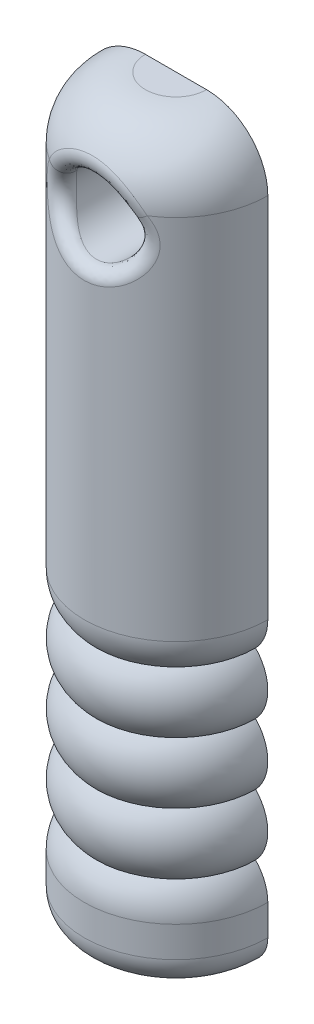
SolidWorks part; units mm, degrees
ref_plane "Front" through (0, 0, 0) normal (0, 0, 1) x (1, 0, 0)
ref_plane "Top" through (0, 0, 0) normal (0, 1, 0) x (1, 0, 0)
ref_plane "Right" through (0, 0, 0) normal (1, 0, 0) x (0, 0, -1)
sketch "Esquisse2" plane through (0, 0, 0) normal (0, 1, 0) x (1, 0, 0)
  circle A0 centre (0, 0) radius 15
  dimension "D1" = 30
extrude "Boss.-Extru.1" add sketch "Esquisse2" along normal blind 120
fillet "Congé1" radius 10 1 edges at (0, 120, 15)
fillet "Congé2" radius 5 1 edges at (0, 0, 15)
sketch "Esquisse3" plane through (0, 0, 0) normal (0, 0, 1) x (1, 0, 0)
  line L0 (-15, 20) -> (-15, 10)
  line L1 (-15, 110) -> (-15, 5) construction
  line L2 (-15, 15) -> (-13, 15)
  line L3 (-10, 0) -> (10, 0) construction
  line L4 (0, 0) -> (0, 19.1944) construction
  arc A0 (-15, 10) -> (-13, 15) centre (-7.75, 10) cw
  arc A1 (-15, 20) -> (-13, 15) centre (-7.75, 20) ccw
  dimension "D2" = 7.25
  dimension "D1" = 10
  dimension "D3" = 5
revolve "Enlèvement de matière-Révolution1" cut sketch "Esquisse3" angle 360 about L4
pattern_linear "Répétition linéaire1" count 4 spacing 10 along (0, 1, 0) of "Enlèvement de matière-Révolution1"
sketch "Esquisse4" plane through (0, 0, 0) normal (0, 0, 1) x (1, 0, 0)
  line L0 (5, 120) -> (-5, 120) construction
  circle A0 centre (0, 106) radius 6
  dimension "D2" = 12
  dimension "D1" = 14
extrude "Enlèv. mat.-Extru.1" cut sketch "Esquisse4" against normal mid plane 120
fillet "Congé3" radius 2 4 edges at (0.0283, 100.0001, -15) (-0.0283, 100.0001, 15) (1.0837, 111.9013, 14.7779) (-1.0837, 111.9013, -14.7779)
sketch "Esquisse5" plane through (0, 0, 0) normal (0, -1, 0) x (1, 0, 0)
  line L1 (-5, 1.6) -> (5, 1.6)
  line L2 (-5, 1.6) -> (-5, -1.6)
  line L3 (-5, -1.6) -> (5, -1.6)
  line L4 (5, 1.6) -> (5, -1.6)
  line L5 (-5, 1.6) -> (5, -1.6) construction
  line L6 (-5, -1.6) -> (5, 1.6) construction
  point P0 (0, 0)
  dimension "D1" = 3.2
  dimension "D2" = 10
sketch "Esquisse6" plane through (0, 0, 0) normal (0, 0, 1) x (1, 0, 0)
  line L1 (-43.8641, 151.4993) -> (49.8238, 151.4993)
  line L2 (-43.8641, 151.4993) -> (-43.8641, -51.0701)
  line L3 (-43.8641, -51.0701) -> (49.8238, -51.0701)
  line L4 (49.8238, 151.4993) -> (49.8238, -51.0701)
extrude "Enlèv. mat.-Extru.3" cut sketch "Esquisse6" against normal blind 40
shell "Coque2" thickness 2
fillet "Congé4" radius 2 4 edges at (0, 45, 9.3508) (0, 25, 9.3508) (0, 15, 9.3508) (0, 35, 9.3508)
sketch "Esquisse7" plane through (0, 0, 0) normal (0, 0, -1) x (-1, 0, 0)
  line L1 (-6.5, 0) -> (6.5, 0)
  line L2 (-6.5, 0) -> (-6.5, 42)
  line L3 (-6.5, 42) -> (6.5, 42)
  line L4 (6.5, 0) -> (6.5, 42)
  line L5 (10, 0) -> (-10, 0) construction
  line L6 (5, 0) -> (-5, 0) construction
  line L8 (-5, 40.5) -> (5, 40.5)
  line L9 (5, 1.5) -> (5, 40.5)
  line L10 (-5, 1.5) -> (5, 1.5)
  line L11 (-5, 1.5) -> (-5, 40.5)
  dimension "D1" = 42
  dimension "D2" = 13
  dimension "D3" = 1.5
extrude "Boss.-Extru.2" add sketch "Esquisse7" against normal up to body separate body
extrude "Enlèv. mat.-Extru.4" cut sketch "Esquisse5" against normal up to vertex contours L1 L4 L3 L2
sketch "Esquisse8" plane through (0, 0, 0) normal (0, 0, -1) x (-1, 0, 0)
  line L0 (-2.3848, 30.75) -> (-0.75, 30.75)
  line L1 (0, 30) -> (-2.5, 30) construction
  line L2 (-2.3848, 29.25) -> (-0.75, 29.25)
  line L3 (0, 40.5) -> (0, 30) construction
  line L4 (5, 40.5) -> (-5, 40.5) construction
  line L5 (5, 0) -> (-5, 0) construction
  line L6 (-0.75, 32.3848) -> (-0.75, 30.75)
  line L7 (0.75, 32.3848) -> (0.75, 30.75)
  line L8 (-0.75, 29.25) -> (-0.75, 27.6152)
  line L9 (0.75, 30.75) -> (2.3848, 30.75)
  line L10 (0.75, 29.25) -> (0.75, 27.6152)
  line L11 (0.75, 29.25) -> (2.3848, 29.25)
  line L12 (-2.3848, 10.75) -> (-0.75, 10.75)
  line L13 (-0.75, 12.3848) -> (-0.75, 10.75)
  line L14 (0.75, 12.3848) -> (0.75, 10.75)
  line L15 (0.75, 10.75) -> (2.3848, 10.75)
  line L16 (0.75, 9.25) -> (2.3848, 9.25)
  line L17 (0.75, 9.25) -> (0.75, 7.6152)
  line L18 (-0.75, 9.25) -> (-0.75, 7.6152)
  line L19 (-2.3848, 9.25) -> (-0.75, 9.25)
  line L20 (0, 30) -> (0, 10) construction
  arc A1 (-2.3848, 30.75) -> (-2.3848, 29.25) centre (0, 30) ccw
  arc A2 (2.3848, 29.25) -> (2.3848, 30.75) centre (0, 30) ccw
  arc A3 (-0.75, 32.3848) -> (0.75, 32.3848) centre (0, 30) cw
  arc A4 (-0.75, 27.6152) -> (0.75, 27.6152) centre (0, 30) ccw
  arc A5 (-0.75, 12.3848) -> (0.75, 12.3848) centre (0, 10) cw
  arc A6 (2.3848, 9.25) -> (2.3848, 10.75) centre (0, 10) ccw
  arc A7 (-0.75, 7.6152) -> (0.75, 7.6152) centre (0, 10) ccw
  arc A8 (-2.3848, 10.75) -> (-2.3848, 9.25) centre (0, 10) ccw
  dimension "D3" = 2.5
  dimension "D1" = 1.5
  dimension "D2" = 30
  dimension "D4" = 1.5
  dimension "D6" = 20
  dimension "D5" = 2
extrude "Boss.-Extru.3" add sketch "Esquisse8" against normal up to body separate body
sketch "Esquisse9" plane through (0, 0, 1.6) normal (0, 0, -1) x (-1, 0, 0)
  line L0 (-5, 40.5) -> (-5, 0) construction
  line L1 (-5, 30.75) -> (5, 30.75)
  line L2 (-5, 30.75) -> (-5, 29.25)
  line L3 (-5, 29.25) -> (5, 29.25)
  line L4 (5, 30.75) -> (5, 29.25)
  line L5 (5, 33.6207) -> (5, 26.3793) construction
  line L6 (2.3848, 30.75) -> (0.75, 30.75) construction
  line L7 (0.75, 29.25) -> (2.3848, 29.25) construction
  line L8 (-5, 10) -> (-5, 13.6207) construction
  line L9 (-5, 10.75) -> (5, 10.75)
  line L10 (-5, 10.75) -> (-5, 9.25)
  line L11 (-5, 9.25) -> (5, 9.25)
  line L12 (5, 10.75) -> (5, 9.25)
  line L13 (5, 10) -> (5, 5) construction
  line L14 (2.3848, 10.75) -> (0.75, 10.75) construction
  line L15 (0.75, 9.25) -> (2.3848, 9.25) construction
  line L16 (-5, 40.5) -> (5, 40.5) construction
  line L17 (-0.75, 40.5) -> (0.75, 40.5)
  line L18 (-0.75, 40.5) -> (-0.75, 2)
  line L19 (-0.75, 2) -> (0.75, 2)
  line L20 (0.75, 40.5) -> (0.75, 2)
  line L21 (-5, 2) -> (5, 2) construction
  line L22 (0.75, 30.75) -> (0.75, 32.3848) construction
  line L23 (-0.75, 32.3848) -> (-0.75, 30.75) construction
extrude "Boss.-Extru.4" add sketch "Esquisse9" against normal up to body separate body contours L18 L1 L2 L3 | L1 L20 L3 L4 | L9 L20 L11 L12 | L18 L9 L10 L11
sketch "Esquisse10" plane through (0, 0, 0) normal (0, 0, -1) x (-1, 0, 0)
  line L0 (13, 85.5788) -> (-13, 85.5788)
  line L1 (13, 110) -> (13, 50) construction
  line L2 (-13, 50) -> (-13, 110) construction
  line L3 (-13, 55.865) -> (13, 55.865)
  line L4 (0, 42) -> (0, 98)
  line L5 (6.5, 42) -> (-6.5, 42) construction
  line L6 (0, 98) -> (0, 114) construction
  line L7 (0, 114) -> (0, 118)
  line L8 (-5, 118) -> (5, 118) construction
  arc A0 (-6.9282, 110) -> (6.9282, 110) centre (0, 106) ccw construction
  arc A1 (6.9282, 110) -> (-6.9282, 110) centre (0, 106) ccw construction
rib "Nervure1" sketch "Esquisse10" sketch "Esquisse10" thickness 1.5 extrusion direction normal to sketch draft on no parameters "D1"=1.5
